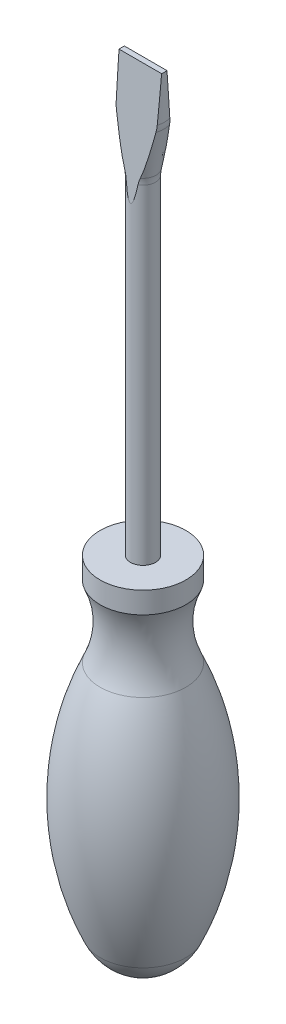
SolidWorks part; units mm, degrees
ref_plane "Front Plane" through (0, 0, 0) normal (0, 0, 1) x (1, 0, 0)
ref_plane "Top Plane" through (0, 0, 0) normal (0, 1, 0) x (1, 0, 0)
ref_plane "Right Plane" through (0, 0, 0) normal (1, 0, 0) x (0, 0, -1)
sketch "BBox" plane through (0, 0, 0) normal (1, 0, 0) x (0, 0, -1)
  line L4 (0, 0) -> (0, 220) construction
  line L5 (0, 100) -> (12, 100) construction
  line L6 (12, 100) -> (12, 0)
  line L7 (12, 0) -> (0, 0)
  line L8 (0, 220) -> (3.5, 220)
  line L9 (3.5, 220) -> (3.5, 100)
  dimension "D1" = 220
  dimension "D2" = 100
  dimension "D3" = 12
  dimension "D4" = 3.5
sketch "Handle" plane through (0, 0, 0) normal (1, 0, 0) x (0, 0, -1)
  line L4 (12, 100) -> (12, 94)
  line L5 (12, 100) -> (12, 0) construction
  line L7 (12, 100) -> (0, 100)
  line L8 (0, 100) -> (0, 0)
  arc A0 (12, 94) -> (12, 74) centre (34.2313, 84) ccw
  arc A1 (12, 74) -> (12, 8.5) centre (-60.8075, 41.25) cw
  arc A2 (12, 8.5) -> (0, 0) centre (-1.2238, 14.4483) cw
  dimension "D1" = 8.5
  dimension "D2" = 14.5
  dimension "D3" = 6
  dimension "D4" = 20
sketch "Grips" plane through (0, 0, 0) normal (1, 0, 0) x (0, 0, -1)
  line L0 (12, 74) -> (32.9937, 74)
  line L1 (32.9937, 74) -> (32.9937, 20)
  line L2 (32.9937, 20) -> (16.1466, 20)
  line L3 (0, 0) -> (0, 99.8972) construction
  line L4 (-32.9937, 20) -> (-16.1466, 20)
  line L5 (-32.9937, 74) -> (-32.9937, 20)
  line L6 (-12, 74) -> (-32.9937, 74)
  arc A0 (12, 74) -> (16.1466, 20) centre (67.4577, 51.0993) ccw
  arc A1 (12, 8.5) -> (12, 74) centre (-60.8075, 41.25) ccw construction
  arc A3 (-12, 74) -> (-16.1466, 20) centre (-67.4577, 51.0993) cw
  dimension "D1" = 60
  dimension "D2" = 20
revolve "Revolve1" add sketch "Handle" angle 360 about L8
sketch "Sketch4" plane through (0, 0, 0) normal (1, 0, 0) x (0, 0, -1)
  line L1 (3.5, 192.1141) -> (3.5, 30)
  line L2 (3.5, 30) -> (0, 30)
  line L3 (0, 0) -> (0, 220) construction
  line L4 (0, 30) -> (0, 220)
  line L5 (3.6557, 193.8721) -> (5.8443, 206.1279)
  line L7 (6, 207.8859) -> (6, 220)
  line L9 (0, 220) -> (6, 220)
  arc A0 (5.8443, 206.1279) -> (6, 207.8859) centre (-4, 207.8859) ccw
  arc A1 (3.6557, 193.8721) -> (3.5, 192.1141) centre (13.5, 192.1141) ccw
  point P12 (6, 207)
  point P16 (3.5, 193)
  dimension "D2" = 6
  dimension "D5" = 10
  dimension "D1" = 30
  dimension "D3" = 13
  dimension "D4" = 14
revolve "Revolve2" add sketch "Sketch4" angle 360 about L4
sketch "Sketch5" plane through (0, 0, 0) normal (0, 0, 1) x (1, 0, 0)
  line L0 (3.5, 80) -> (7.5, 75)
  line L1 (3.5, 30) -> (3.5, 192.1141) construction
  line L2 (7.5, 75) -> (7.5, 65)
  line L3 (7.5, 65) -> (3.5, 60)
  line L4 (3.5, 60) -> (-3.5, 60)
  line L5 (0, 0) -> (0, 220) construction
  line L6 (0, 60) -> (0, 80) construction
  line L7 (-3.5, 80) -> (3.5, 80)
  line L8 (-7.5, 65) -> (-3.5, 60)
  line L9 (-7.5, 75) -> (-7.5, 65)
  line L10 (-3.5, 80) -> (-7.5, 75)
  dimension "D1" = 7.5
  dimension "D2" = 60
  dimension "D3" = 20
  dimension "D4" = 10
extrude "Boss-Extrude2" add sketch "Sketch5" along normal mid plane 3
sketch "Sketch11" plane through (0, 0, 0) normal (1, 0, 0) x (0, 0, -1)
  line L0 (0.75, 220) -> (3.5, 187)
  line L1 (0, 220) -> (3.5, 220) construction
  line L2 (3.5, 220) -> (3.5, 100) construction
  line L3 (0.75, 220) -> (0, 220)
  line L4 (0, 220) -> (0, 230.4461) construction
  line L5 (0.75, 220) -> (10.893, 220)
  line L6 (10.893, 220) -> (10.893, 187)
  line L7 (10.893, 187) -> (3.5, 187)
  line L8 (-0.75, 220) -> (-10.893, 220)
  line L9 (-10.893, 220) -> (-10.893, 187)
  line L10 (-10.893, 187) -> (-3.5, 187)
  line L11 (-0.75, 220) -> (-3.5, 187)
  dimension "D1" = 33
  dimension "D2" = 0.75
extrude "Cut-Extrude4" cut sketch "Sketch11" against normal mid plane 20 contours L7 L6 L5 L0 | L11 L8 L9 L10
sketch "Sketch14" plane through (0, 0, 0) normal (1, 0, 0) x (0, 0, -1)
  line L0 (21.5489, 27) -> (20.6466, 27)
  line L1 (20.6466, 27) -> (20.6466, 62.5)
  line L2 (20.6466, 62.5) -> (16.1466, 62.5)
  line L3 (17.7466, 27) -> (20.6466, 27)
  arc A1 (12, 8.5) -> (12, 74) centre (-60.8075, 41.25) ccw construction
  arc A3 (16.1466, 62.5) -> (17.7466, 27) centre (215.9537, 53.7193) ccw
  dimension "D1" = 4.5
  dimension "D4" = 200
  dimension "D2" = 35.5
  dimension "D3" = 27
  dimension "D5" = 2.9
sketch "Sketch13" plane through (0, 0, 0) normal (1, 0, 0) x (0, 0, -1)
  line L0 (0, 0) -> (0, 102.6432) construction
  line L1 (6.25, 60.8177) -> (12.5, 58.2682)
  line L2 (12.5, 58.2682) -> (12.5, 49.099)
  line L3 (12.5, 49.099) -> (6.25, 46.5495)
  line L4 (-12.5, 39) -> (-7.9779, 39)
  line L5 (12.5, 39) -> (15.0478, 32)
  line L6 (15.0478, 32) -> (9.3864, 26.7329)
  line L7 (0, 63.3672) -> (0, 44) construction
  line L8 (0, 39) -> (0, 18) construction
  line L9 (-15.0478, 32) -> (-9.3864, 26.7329)
  line L10 (-12.5, 39) -> (-15.0478, 32)
  line L11 (-12.5, 49.099) -> (-6.25, 46.5495)
  line L12 (-12.5, 58.2682) -> (-12.5, 49.099)
  line L13 (-6.25, 60.8177) -> (-12.5, 58.2682)
  line L14 (6.25, 58.6577) -> (10.5, 56.924)
  line L15 (10.5, 56.924) -> (10.5, 50.4432)
  line L16 (10.5, 50.4432) -> (6.25, 48.7095)
  line L17 (-10.5, 50.4432) -> (-6.25, 48.7095)
  line L18 (-10.5, 56.924) -> (-10.5, 50.4432)
  line L19 (-6.25, 58.6577) -> (-10.5, 56.924)
  line L20 (11.0996, 37) -> (12.7151, 32.5615)
  line L21 (12.7151, 32.5615) -> (9.103, 29.2009)
  line L22 (-12.7151, 32.5615) -> (-9.103, 29.2009)
  line L23 (-11.0996, 37) -> (-12.7151, 32.5615)
  line L24 (-11.0996, 37) -> (-8.2075, 37)
  line L25 (-6.25, 60.8177) -> (-6.25, 46.5495)
  line L26 (-7.9779, 39) -> (-9.3864, 26.7329)
  line L27 (7.9779, 39) -> (9.3864, 26.7329)
  line L28 (6.25, 60.8177) -> (6.25, 46.5495)
  line L29 (0, 63.3672) -> (-12.5, 58.2682) construction
  line L30 (0, 61.2072) -> (-10.5, 56.924) construction
  line L31 (0, 63.3672) -> (12.5, 58.2682) construction
  line L32 (0, 61.2072) -> (10.5, 56.924) construction
  line L33 (10.5, 50.4432) -> (0, 46.16) construction
  line L34 (12.5, 49.099) -> (0, 44) construction
  line L35 (-10.5, 50.4432) -> (0, 46.16) construction
  line L36 (-12.5, 49.099) -> (0, 44) construction
  line L37 (7.9779, 39) -> (12.5, 39)
  line L38 (-12.5, 39) -> (12.5, 39) construction
  line L39 (8.2075, 37) -> (11.0996, 37)
  line L40 (-11.0996, 37) -> (11.0996, 37) construction
  line L41 (-12.7151, 32.5615) -> (0, 20.7317) construction
  line L42 (-15.0478, 32) -> (0, 18) construction
  line L43 (12.7151, 32.5615) -> (0, 20.7317) construction
  line L44 (15.0478, 32) -> (0, 18) construction
  dimension "D1" = 12.5
  dimension "D2" = 12.5
  dimension "D3" = 18
  dimension "D4" = 44
  dimension "D5" = 19.3672
  dimension "D6" = 110
  dimension "D7" = 7
  dimension "D8" = 14
  dimension "D9" = 13.5
  dimension "D10" = 2
extrude "Cut-Extrude5" cut sketch "Sketch14" against normal through all both and the other way through all contours L1 L2 A3 L3
